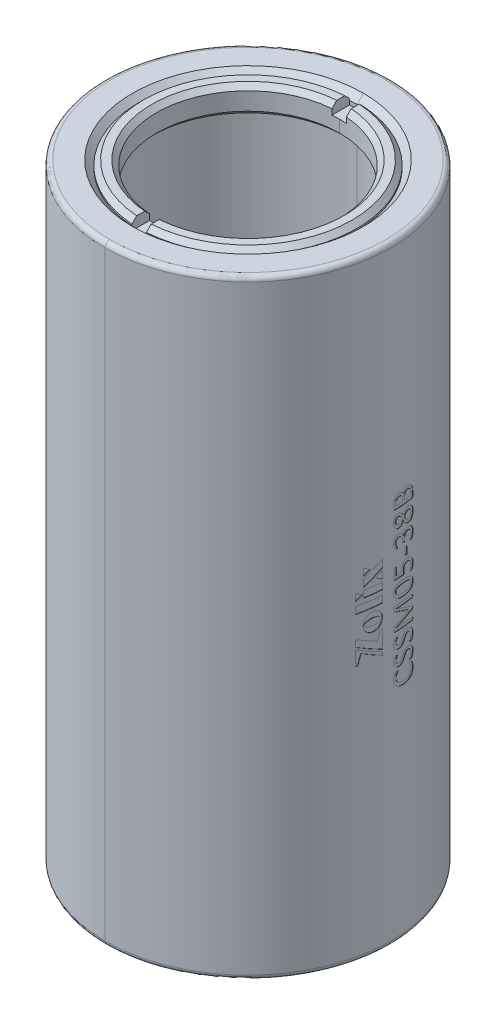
SolidWorks part; units mm, degrees
ref_plane "前视基准面" through (0, 0, 0) normal (0, 0, 1) x (1, 0, 0)
ref_plane "上视基准面" through (0, 0, 0) normal (0, 1, 0) x (1, 0, 0)
ref_plane "右视基准面" through (0, 0, 0) normal (1, 0, 0) x (0, 0, -1)
imported_body "SM05卡环.STEP-1-solid1"
imported_body "SM05卡环.STEP-2-solid1"
imported_body "CSSM05-38B-1.STEP-1-solid1"
sketch "草图1" plane through (0, 0, 0) normal (1, 0, 0) x (0, 0, -1)
  line L0 (8.9, 26.5082) -> (8.9, -10.8918) construction
  line L1 (1.5, 1.8082) -> (1.5, 13.8082) construction
  text T0 "CSSM05-38B" font "Calibri" height 1.3
  point P0 (-0.5, 7.8082)
  point P3 (8.9, 7.8082)
  point P7 (1.5, 7.8082)
  line B0 (-0.5, 8.0208) -> (-0.5, 7.5957)
  line B1 (-0.5, 7.5957) -> (-1.9984, 7.5957)
  line B2 (-1.9984, 7.5957) -> (-1.9984, 8.0208)
  line B3 (-1.9984, 8.0208) -> (-0.5, 8.0208)
  line B4 (-1.5827, 8.887) -> (-1.5827, 9.3766)
  line B5 (-1.5827, 9.3766) -> (-0.5, 9.9712)
  line B6 (-0.5, 9.9712) -> (-0.5, 9.491)
  line B7 (-0.5, 9.491) -> (-1.5827, 8.887)
  line B8 (-1.5827, 9.4963) -> (-1.5827, 9.9402)
  line B9 (-1.5827, 9.9402) -> (-1.2035, 9.7183)
  line B10 (-1.2035, 9.7183) -> (-1.5827, 9.4963)
  line B11 (-0.9157, 9.1372) -> (-0.5, 8.8845)
  line B12 (-0.5, 8.8845) -> (-0.5, 9.3632)
  line B13 (-0.5, 9.3632) -> (-0.9157, 9.1372)
  line B14 (-1.0488, 6.615) -> (-1.1109, 6.6171)
  line B15 (-1.1109, 6.6171) -> (-1.1696, 6.6236)
  line B16 (-1.1696, 6.6236) -> (-1.2248, 6.6338)
  line B17 (-1.2248, 6.6338) -> (-1.2766, 6.647)
  line B18 (-1.2766, 6.647) -> (-1.3247, 6.6624)
  line B19 (-1.3247, 6.6624) -> (-1.369, 6.6798)
  line B20 (-1.369, 6.6798) -> (-1.4096, 6.6982)
  line B21 (-1.4096, 6.6982) -> (-1.4463, 6.7172)
  line B22 (-1.4463, 6.7172) -> (-1.4789, 6.7364)
  line B23 (-1.4789, 6.7364) -> (-1.5076, 6.7551)
  line B24 (-1.5076, 6.7551) -> (-1.532, 6.7724)
  line B25 (-1.532, 6.7724) -> (-1.5523, 6.7881)
  line B26 (-1.5523, 6.7881) -> (-1.5682, 6.8012)
  line B27 (-1.5682, 6.8012) -> (-1.5799, 6.8114)
  line B28 (-1.5799, 6.8114) -> (-1.5869, 6.8183)
  line B29 (-1.5869, 6.8183) -> (-1.5895, 6.8207)
  line B30 (-1.5895, 6.8207) -> (-1.5895, 6.8193)
  line B31 (-1.5895, 6.8193) -> (-1.5867, 6.7642)
  line B32 (-1.5867, 6.7642) -> (-1.5785, 6.7104)
  line B33 (-1.5785, 6.7104) -> (-1.5652, 6.6586)
  line B34 (-1.5652, 6.6586) -> (-1.547, 6.6088)
  line B35 (-1.547, 6.6088) -> (-1.5242, 6.5616)
  line B36 (-1.5242, 6.5616) -> (-1.4972, 6.517)
  line B37 (-1.4972, 6.517) -> (-1.466, 6.4755)
  line B38 (-1.466, 6.4755) -> (-1.4311, 6.4371)
  line B39 (-1.4311, 6.4371) -> (-1.3927, 6.4023)
  line B40 (-1.3927, 6.4023) -> (-1.3511, 6.3709)
  line B41 (-1.3511, 6.3709) -> (-1.3065, 6.3439)
  line B42 (-1.3065, 6.3439) -> (-1.2593, 6.3211)
  line B43 (-1.2593, 6.3211) -> (-1.2095, 6.3031)
  line B44 (-1.2095, 6.3031) -> (-1.1578, 6.2898)
  line B45 (-1.1578, 6.2898) -> (-1.1041, 6.2815)
  line B46 (-1.1041, 6.2815) -> (-1.0488, 6.2786)
  line B47 (-1.0488, 6.2786) -> (-0.9935, 6.2815)
  line B48 (-0.9935, 6.2815) -> (-0.9399, 6.2898)
  line B49 (-0.9399, 6.2898) -> (-0.888, 6.3031)
  line B50 (-0.888, 6.3031) -> (-0.8383, 6.3211)
  line B51 (-0.8383, 6.3211) -> (-0.7911, 6.3439)
  line B52 (-0.7911, 6.3439) -> (-0.7465, 6.3709)
  line B53 (-0.7465, 6.3709) -> (-0.7048, 6.4023)
  line B54 (-0.7048, 6.4023) -> (-0.6664, 6.4371)
  line B55 (-0.6664, 6.4371) -> (-0.6314, 6.4755)
  line B56 (-0.6314, 6.4755) -> (-0.6004, 6.517)
  line B57 (-0.6004, 6.517) -> (-0.5732, 6.5616)
  line B58 (-0.5732, 6.5616) -> (-0.5505, 6.6088)
  line B59 (-0.5505, 6.6088) -> (-0.5324, 6.6586)
  line B60 (-0.5324, 6.6586) -> (-0.5189, 6.7104)
  line B61 (-0.5189, 6.7104) -> (-0.5109, 6.7642)
  line B62 (-0.5109, 6.7642) -> (-0.5081, 6.8193)
  line B63 (-0.5081, 6.8193) -> (-0.5081, 6.8207)
  line B64 (-0.5081, 6.8207) -> (-0.5105, 6.8184)
  line B65 (-0.5105, 6.8184) -> (-0.5177, 6.8119)
  line B66 (-0.5177, 6.8119) -> (-0.5295, 6.8017)
  line B67 (-0.5295, 6.8017) -> (-0.5453, 6.7885)
  line B68 (-0.5453, 6.7885) -> (-0.5658, 6.773)
  line B69 (-0.5658, 6.773) -> (-0.5904, 6.7556)
  line B70 (-0.5904, 6.7556) -> (-0.619, 6.737)
  line B71 (-0.619, 6.737) -> (-0.6518, 6.7178)
  line B72 (-0.6518, 6.7178) -> (-0.6886, 6.6986)
  line B73 (-0.6886, 6.6986) -> (-0.7291, 6.6799)
  line B74 (-0.7291, 6.6799) -> (-0.7735, 6.6626)
  line B75 (-0.7735, 6.6626) -> (-0.8214, 6.647)
  line B76 (-0.8214, 6.647) -> (-0.8731, 6.634)
  line B77 (-0.8731, 6.634) -> (-0.9283, 6.6238)
  line B78 (-0.9283, 6.6238) -> (-0.9869, 6.6171)
  line B79 (-0.9869, 6.6171) -> (-1.0488, 6.615)
  line B80 (-1.5895, 6.8307) -> (-1.5869, 6.8331)
  line B81 (-1.5869, 6.8331) -> (-1.5799, 6.8398)
  line B82 (-1.5799, 6.8398) -> (-1.5682, 6.85)
  line B83 (-1.5682, 6.85) -> (-1.5523, 6.8632)
  line B84 (-1.5523, 6.8632) -> (-1.532, 6.8789)
  line B85 (-1.532, 6.8789) -> (-1.5076, 6.8963)
  line B86 (-1.5076, 6.8963) -> (-1.4789, 6.9147)
  line B87 (-1.4789, 6.9147) -> (-1.4463, 6.9339)
  line B88 (-1.4463, 6.9339) -> (-1.4096, 6.953)
  line B89 (-1.4096, 6.953) -> (-1.369, 6.9716)
  line B90 (-1.369, 6.9716) -> (-1.3247, 6.9888)
  line B91 (-1.3247, 6.9888) -> (-1.2766, 7.0043)
  line B92 (-1.2766, 7.0043) -> (-1.2248, 7.0174)
  line B93 (-1.2248, 7.0174) -> (-1.1696, 7.0274)
  line B94 (-1.1696, 7.0274) -> (-1.1109, 7.0339)
  line B95 (-1.1109, 7.0339) -> (-1.0488, 7.0364)
  line B96 (-1.0488, 7.0364) -> (-0.9869, 7.0339)
  line B97 (-0.9869, 7.0339) -> (-0.9283, 7.0274)
  line B98 (-0.9283, 7.0274) -> (-0.8731, 7.0174)
  line B99 (-0.8731, 7.0174) -> (-0.8214, 7.0041)
  line B100 (-0.8214, 7.0041) -> (-0.7735, 6.9886)
  line B101 (-0.7735, 6.9886) -> (-0.7291, 6.9712)
  line B102 (-0.7291, 6.9712) -> (-0.6886, 6.9528)
  line B103 (-0.6886, 6.9528) -> (-0.6518, 6.9335)
  line B104 (-0.6518, 6.9335) -> (-0.619, 6.9144)
  line B105 (-0.619, 6.9144) -> (-0.5904, 6.8958)
  line B106 (-0.5904, 6.8958) -> (-0.5658, 6.8784)
  line B107 (-0.5658, 6.8784) -> (-0.5453, 6.8627)
  line B108 (-0.5453, 6.8627) -> (-0.5295, 6.8496)
  line B109 (-0.5295, 6.8496) -> (-0.5177, 6.8395)
  line B110 (-0.5177, 6.8395) -> (-0.5105, 6.8329)
  line B111 (-0.5105, 6.8329) -> (-0.5081, 6.8307)
  line B112 (-0.5081, 6.8307) -> (-0.511, 6.8856)
  line B113 (-0.511, 6.8856) -> (-0.5195, 6.939)
  line B114 (-0.5195, 6.939) -> (-0.5329, 6.9905)
  line B115 (-0.5329, 6.9905) -> (-0.5512, 7.0398)
  line B116 (-0.5512, 7.0398) -> (-0.5739, 7.0868)
  line B117 (-0.5739, 7.0868) -> (-0.6011, 7.1311)
  line B118 (-0.6011, 7.1311) -> (-0.6321, 7.1724)
  line B119 (-0.6321, 7.1724) -> (-0.6669, 7.2105)
  line B120 (-0.6669, 7.2105) -> (-0.7053, 7.245)
  line B121 (-0.7053, 7.245) -> (-0.7467, 7.2758)
  line B122 (-0.7467, 7.2758) -> (-0.7913, 7.3027)
  line B123 (-0.7913, 7.3027) -> (-0.8384, 7.3252)
  line B124 (-0.8384, 7.3252) -> (-0.8881, 7.3431)
  line B125 (-0.8881, 7.3431) -> (-0.9399, 7.3564)
  line B126 (-0.9399, 7.3564) -> (-0.9935, 7.3647)
  line B127 (-0.9935, 7.3647) -> (-1.0488, 7.3673)
  line B128 (-1.0488, 7.3673) -> (-1.1038, 7.3647)
  line B129 (-1.1038, 7.3647) -> (-1.1572, 7.3564)
  line B130 (-1.1572, 7.3564) -> (-1.2089, 7.3431)
  line B131 (-1.2089, 7.3431) -> (-1.2584, 7.3252)
  line B132 (-1.2584, 7.3252) -> (-1.3054, 7.3027)
  line B133 (-1.3054, 7.3027) -> (-1.3498, 7.2758)
  line B134 (-1.3498, 7.2758) -> (-1.3912, 7.245)
  line B135 (-1.3912, 7.245) -> (-1.4296, 7.2105)
  line B136 (-1.4296, 7.2105) -> (-1.4645, 7.1724)
  line B137 (-1.4645, 7.1724) -> (-1.4955, 7.1311)
  line B138 (-1.4955, 7.1311) -> (-1.5227, 7.0868)
  line B139 (-1.5227, 7.0868) -> (-1.5457, 7.0398)
  line B140 (-1.5457, 7.0398) -> (-1.564, 6.9905)
  line B141 (-1.564, 6.9905) -> (-1.5777, 6.939)
  line B142 (-1.5777, 6.939) -> (-1.5862, 6.8856)
  line B143 (-1.5862, 6.8856) -> (-1.5895, 6.8307)
  line B144 (-1.9997, 6.245) -> (-1.9997, 5.824)
  line B145 (-1.9997, 5.824) -> (-0.5, 5.0854)
  line B146 (-0.5, 5.0854) -> (-0.5, 6.2276)
  line B147 (-0.5, 6.2276) -> (-0.6438, 6.2276)
  line B148 (-0.6438, 6.2276) -> (-0.7985, 5.6569)
  line B149 (-0.7985, 5.6569) -> (-1.9997, 6.245)
  line B150 (-1.9997, 5.6921) -> (-0.5, 4.9536)
  line B151 (-0.5, 4.9536) -> (-0.5, 4.7691)
  line B152 (-0.5, 4.7691) -> (-1.7078, 5.3679)
  line B153 (-1.7078, 5.3679) -> (-1.8827, 4.7855)
  line B154 (-1.8827, 4.7855) -> (-1.9997, 4.7855)
  line B155 (-1.9997, 4.7855) -> (-1.9997, 5.6921)
  line B156 (-0.5, 8.7377) -> (-0.5, 8.314)
  line B157 (-0.5, 8.314) -> (-1.5827, 8.314)
  line B158 (-1.5827, 8.314) -> (-1.5827, 8.7377)
  line B159 (-1.5827, 8.7377) -> (-0.5, 8.7377)
  line B160 (-1.9984, 8.3047) -> (-1.6096, 8.517)
  line B161 (-1.6096, 8.517) -> (-1.9984, 8.7391)
  line B162 (-1.9984, 8.7391) -> (-1.9984, 8.3047)
  dimension "D1" = 0.5
  dimension "D2" = 2
  dimension "D3" = 12
sketch_block_instance "1.5mmLogo字体-1"
sketch_block "1.5mmLogo字体" parameters "D1"=0.0031, "D2"=0.8502, "D3"=0.2341
wrap "包覆1" sketch "草图1" wrap type deboss source sketch "草图1" thickness 0.02 parameters "D1"=0.02
